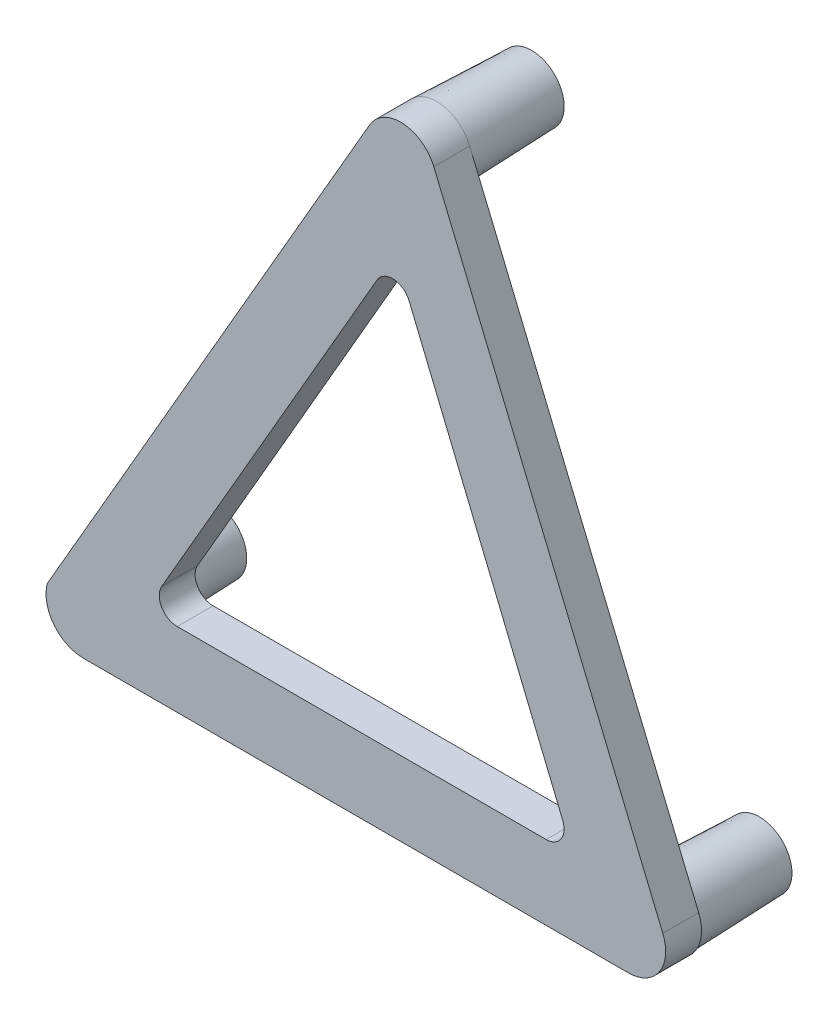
SolidWorks part; units mm, degrees
ref_plane "Plan de face" through (0, 0, 0) normal (0, 0, 1) x (1, 0, 0)
ref_plane "Plan de dessus" through (0, 0, 0) normal (0, 1, 0) x (1, 0, 0)
ref_plane "Plan de droite" through (0, 0, 0) normal (1, 0, 0) x (0, 0, -1)
sketch "Esquisse1" plane through (0, 0, 0) normal (0, 0, 1) x (1, 0, 0)
  line L1 (0, 0) -> (30.4, 0) construction
  line L3 (0, 0) -> (17.7, 30.6573) construction
  line L4 (17.7, 30.6573) -> (0, 0) construction
  line L6 (15.9679, 31.6573) -> (-2.0062, 0.5252)
  line L7 (30.4, 0) -> (0, 0) construction
  line L8 (30.4, -2.0738) -> (0, -2.0738)
  line L10 (30.4, 0) -> (17.7, 30.6573) construction
  line L11 (27.3037, 2.0738) -> (17.3987, 26.1353)
  line L12 (32.3141, 0.7979) -> (19.546, 31.4268)
  line L13 (17.3987, 26.1353) -> (3.5067, 2.0738)
  line L14 (27.3037, 2.0738) -> (3.5067, 2.0738)
  arc A2 (19.546, 31.4268) -> (15.9679, 31.6573) centre (17.7, 30.6573) ccw
  arc A3 (-2.0062, 0.5252) -> (0, -2.0738) centre (0, 0) ccw
  arc A6 (30.4, -2.0738) -> (32.3141, 0.7979) centre (30.4, 0) ccw
  point P1 (17.6157, 32.6555)
  point P9 (15, 0)
  point P15 (24.7227, 9.7227)
  dimension "D1" = 4
  dimension "D3" = 30.4
  dimension "D4" = 35.4
  dimension "D5" = 60
extrude "Boss.-Extru.1" add sketch "Esquisse1" along normal blind 2
fillet "Congé1" radius 1 3 edges at (27.3037, 2.0738, 1) (3.5067, 2.0738, 1) (17.3987, 26.1353, 1)
sketch "Esquisse2" plane through (0, 0, 0) normal (0, 0, 1) x (1, 0, 0)
  circle A1 centre (30.4, 0) radius 2
  circle A2 centre (0, 0) radius 2
  circle A5 centre (17.7, 30.6573) radius 2
  dimension "D2" = 4
extrude "Boss.-Extru.2" add sketch "Esquisse2" against normal blind 5.3 draft 2
